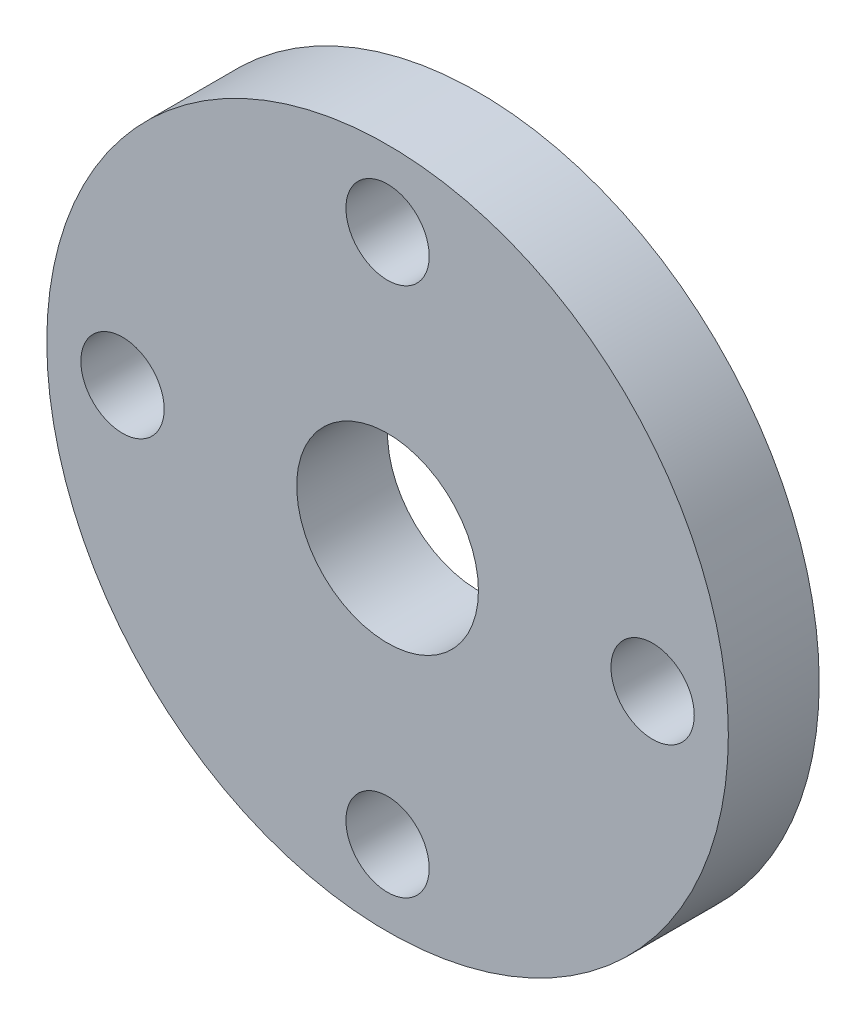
SolidWorks part; units mm, degrees
ref_plane "Front Plane" through (0, 0, 0) normal (0, 0, 1) x (1, 0, 0)
ref_plane "Top Plane" through (0, 0, 0) normal (0, 1, 0) x (1, 0, 0)
ref_plane "Right Plane" through (0, 0, 0) normal (1, 0, 0) x (0, 0, -1)
sketch "Sketch1" plane through (0, 0, 0) normal (0, 0, 1) x (1, 0, 0)
  line L0 (0, -1000) -> (0, 49000) construction
  circle A0 centre (0, 0) radius 22.5
  circle A1 centre (0, 0) radius 17.5 construction
  circle A2 centre (0, 0) radius 6
  circle A3 centre (0, 17.5) radius 2.75
  circle A4 centre (17.5, 0) radius 2.75
  circle A5 centre (0, -17.5) radius 2.75
  circle A6 centre (-17.5, 0) radius 2.75
  point P18 (0, 0)
  dimension "D1" = 45
  dimension "D2" = 12
  dimension "D3" = 35
  dimension "D4" = 5.5
  dimension "D5" = 4
extrude "Boss-Extrude1" add sketch "Sketch1" along normal blind 6
